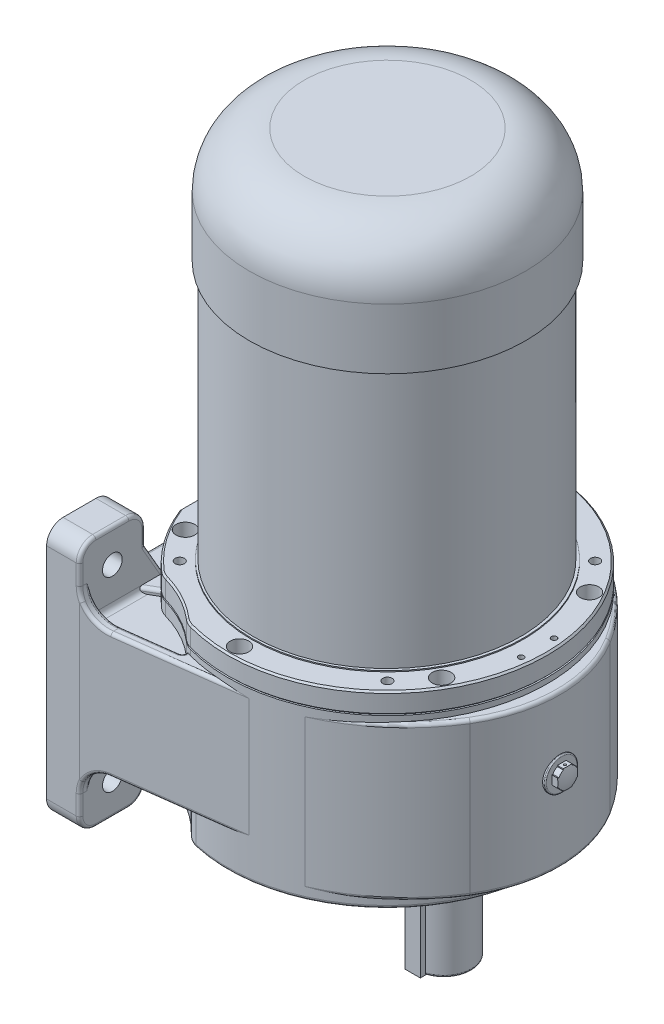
SolidWorks part; units mm, degrees
ref_plane "前视基准面" through (0, 0, 0) normal (0, 0, 1) x (1, 0, 0)
ref_plane "上视基准面" through (0, 0, 0) normal (0, 1, 0) x (1, 0, 0)
ref_plane "右视基准面" through (0, 0, 0) normal (1, 0, 0) x (0, 0, -1)
imported_body "50箱盖-1-surface1"
imported_body "卧式箱体-1-surface1"
imported_body "卧式箱体-1-surface2"
imported_body "卧式箱体-1-surface3"
imported_body "复件 5034.2200.106-00-1-surface2"
imported_body "复件 5034.2200.106-00-1-surface3"
imported_body "复件 5034.2200.106-00-1-surface4"
imported_body "复件 5034.2200.106-00-1-surface5"
imported_body "复件 5034.2200.106-00-1-surface6"
imported_body "复件 5034.2200.106-00-1-surface7"
imported_body "复件 5034.2200.106-00-1-surface8"
imported_body "复件 5034.2200.106-00-1-surface9"
imported_body "复件 5034.2200.106-00-1-surface10"
imported_body "复件 5034.2200.106-00-1-surface11"
imported_body "复件 5034.2200.106-00-1-surface12"
imported_body "复件 5034.2200.106-00-1-surface13"
imported_body "复件 5034.2200.106-00-1-surface14"
imported_body "复件 5034.2200.106-00-1-surface15"
imported_body "复件 5034.2200.106-00-1-surface16"
imported_body "复件 5034.2200.106-00-1-surface17"
imported_body "复件 5034.2200.106-00-1-surface18"
imported_body "复件 5034.2200.106-00-1-surface19"
imported_body "复件 5034.2200.106-00-1-surface20"
imported_body "复件 5034.2200.106-00-1-surface21"
imported_body "复件 5034.2200.106-00-1-surface22"
imported_body "复件 5034.2200.106-00-1-surface23"
imported_body "复件 5034.2200.106-00-1-surface24"
imported_body "复件 5034.2200.106-00-1-surface25"
imported_body "复件 5034.2200.106-00-1-surface26"
imported_body "复件 5034.2200.106-00-1-surface27"
imported_body "复件 5034.2200.106-00-1-surface28"
imported_body "复件 5034.2200.106-00-1-surface29"
imported_body "复件 5034.2200.106-00-1-surface30"
imported_body "复件 5034.2200.106-00-1-surface31"
imported_body "复件 5034.2200.106-00-1-surface32"
imported_body "复件 5034.2200.106-00-1-surface33"
imported_body "复件 5034.2200.106-00-1-surface34"
imported_body "复件 5034.2200.106-00-1-surface35"
imported_body "复件 5034.2200.106-00-1-surface36"
imported_body "复件 5034.2200.106-00-1-surface37"
imported_body "复件 5034.2200.106-00-1-surface38"
imported_body "复件 5034.2200.106-00-1-surface39"
imported_body "复件 5034.2200.106-00-1-surface40"
imported_body "复件 5034.2200.106-00-1-surface41"
imported_body "复件 5034.2200.106-00-1-surface42"
imported_body "复件 5034.2200.106-00-1-surface43"
imported_body "复件 5034.2200.106-00-1-surface44"
imported_body "复件 5034.2200.106-00-1-surface45"
imported_body "复件 5034.2200.106-00-1-surface46"
imported_body "复件 5034.2200.106-00-1-surface47"
imported_body "复件 5034.2200.106-00-1-surface48"
imported_body "复件 5034.2200.106-00-1-surface49"
imported_body "复件 5034.2200.106-00-1-surface50"
imported_body "复件 5034.2200.106-00-1-surface51"
imported_body "复件 5034.2200.106-00-1-surface52"
imported_body "复件 5034.2200.106-00-1-surface53"
imported_body "复件 5034.2200.106-00-1-surface54"
imported_body "复件 5034.2200.106-00-1-surface55"
imported_body "复件 5034.2200.106-00-1-surface56"
imported_body "复件 5034.2200.106-00-1-surface57"
imported_body "复件 5034.2200.106-00-1-surface58"
imported_body "复件 5034.2200.106-00-1-surface59"
imported_body "复件 5034.2200.106-00-1-surface60"
imported_body "复件 5034.2200.106-00-1-surface61"
imported_body "透气塞-1-surface1"
sketch "草图1" plane through (0, -196.7551, 0) normal (0, 1, 0) x (1, 0, 0)
  circle A0 centre (15.5509, 127.454) radius 122
  circle A1 centre (67.5509, 127.454) radius 52 construction
extrude "凸台-拉伸1" add sketch "草图1" along normal blind 237
sketch "草图2" plane through (0, 40.2449, 0) normal (0, 1, 0) x (1, 0, 0)
  circle A0 centre (16.0509, 127.454) radius 126
extrude "凸台-拉伸2" add sketch "草图2" along normal blind 105 separate body
fillet "圆角1" radius 50 1 edges at (16.0509, 145.2449, -1.454)
